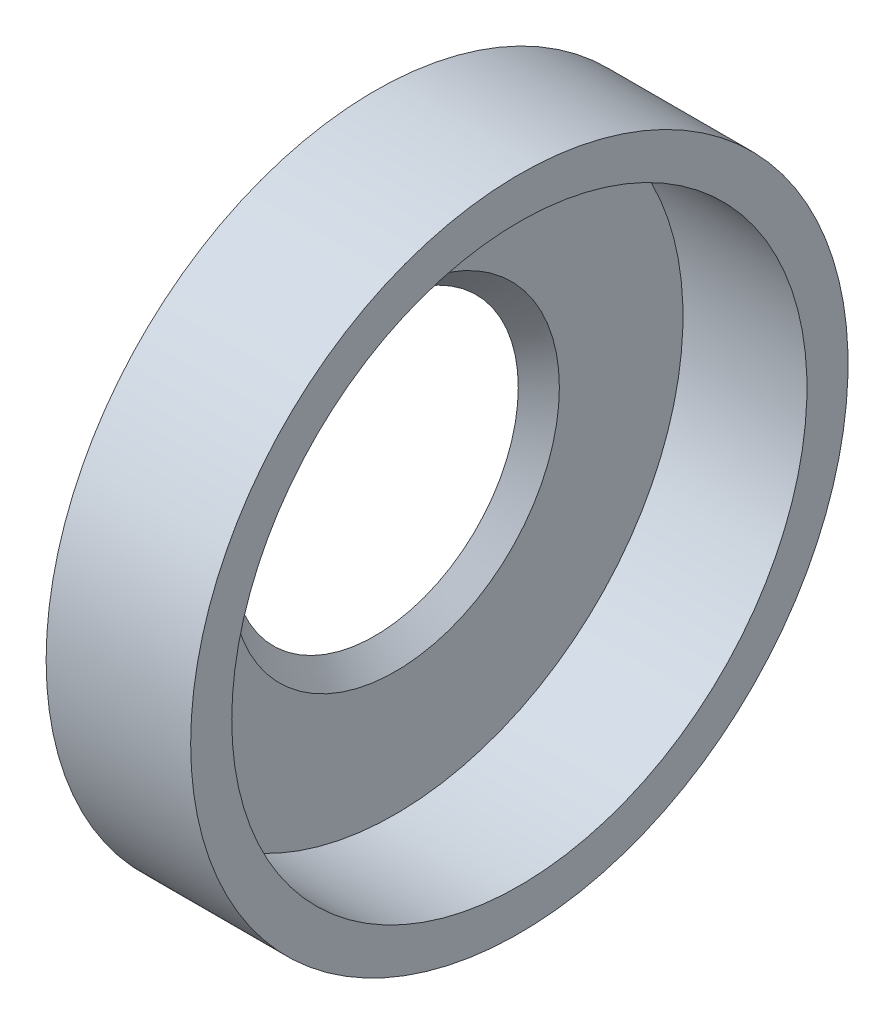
SolidWorks part; units mm, degrees
ref_plane "Front Plane" through (0, 0, 0) normal (0, 0, 1) x (1, 0, 0)
ref_plane "Top Plane" through (0, 0, 0) normal (0, 1, 0) x (1, 0, 0)
ref_plane "Right Plane" through (0, 0, 0) normal (1, 0, 0) x (0, 0, -1)
sketch "Sketch1" plane through (0, 0, 0) normal (0, 0, 1) x (1, 0, 0)
  line L0 (0, 0) -> (82.7027, 0) construction
  line L1 (0, 5.5426) -> (0, 12.7)
  line L2 (0, 12.7) -> (5.5842, 12.7)
  line L3 (5.5842, 12.7) -> (5.5842, 11.1125)
  line L4 (5.5842, 11.1125) -> (0.7938, 11.1125)
  line L5 (0.7938, 11.1125) -> (0.7938, 6.3364)
  line L6 (0.7938, 6.3364) -> (0, 5.5426)
  dimension "D1" = 5.5426
  dimension "D2" = 0.7937
  dimension "D3" = 1.5875
  dimension "D4" = 11.1125
  dimension "D5" = 5.5842
  dimension "D6" = 45
revolve "Revolve1" add sketch "Sketch1" angle 360 about L0
